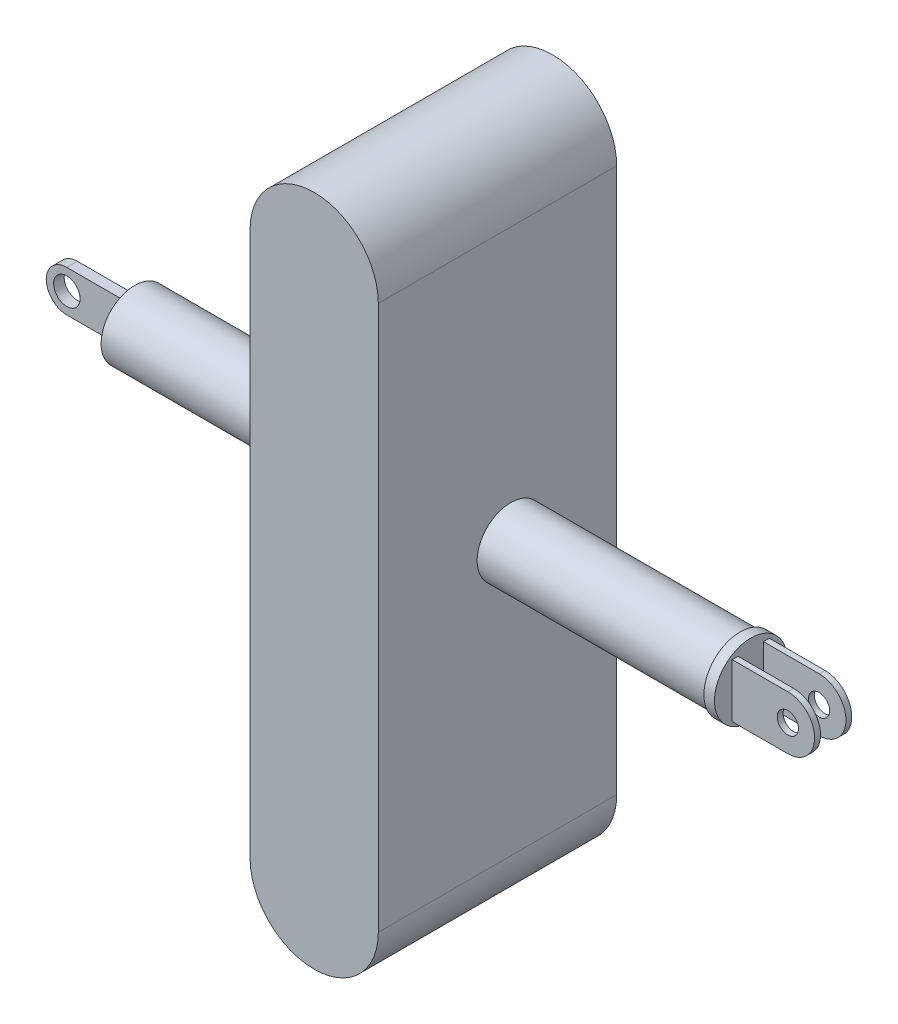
SolidWorks part; units mm, degrees
ref_plane "Front Plane" through (0, 0, 0) normal (0, 0, 1) x (1, 0, 0)
ref_plane "Top Plane" through (0, 0, 0) normal (0, 1, 0) x (1, 0, 0)
ref_plane "Right Plane" through (0, 0, 0) normal (1, 0, 0) x (0, 0, -1)
sketch "Sketch1" plane through (0, 0, 0) normal (1, 0, 0) x (0, 0, -1)
  circle A0 centre (0, 0) radius 12.7
  dimension "D1" = 25.4
extrude "Extrude1" add sketch "Sketch1" along normal blind 228.6
sketch "Sketch2" plane through (0, 0, 0) normal (0, 0, 1) x (1, 0, 0)
  line L0 (0, 0) -> (-32.8673, 0) construction
  line L1 (15.07, 0) -> (-15.07, 0) construction
  line L2 (0, 7.7781) -> (-23.6251, 7.7781)
  line L3 (0, 12.7) -> (0, -12.7) construction
  line L4 (0, -7.7781) -> (-23.6251, -7.7781)
  line L5 (0, 7.7781) -> (0, -7.7781)
  arc A0 (-23.6251, 7.7781) -> (-23.6251, -7.7781) centre (-23.6251, 0) ccw
  circle A1 centre (-23.6251, 0) radius 5
  dimension "D1" = 10
extrude "Extrude2" add sketch "Sketch2" along normal mid plane 4
sketch "Sketch3" plane through (228.6, 0, 0) normal (1, 0, 0) x (0, 0, -1)
  circle A2 centre (0, 0) radius 13.7
  circle A3 centre (0, 0) radius 13.7
  dimension "D1" = 1
extrude "Extrude3" add sketch "Sketch3" along normal blind 4
sketch "Sketch4" plane through (0, 0, 0) normal (0, 0, 1) x (1, 0, 0)
  line L0 (232.6, 10.1329) -> (253.6, 10.1329)
  line L1 (232.6, -13.7) -> (232.6, 13.7) construction
  line L2 (331.2897, 0) -> (364.956, 0) construction
  line L3 (232.6, -10.1329) -> (253.6, -10.1329)
  line L4 (232.6, 10.1329) -> (232.6, -10.1329)
  arc A0 (253.6, 10.1329) -> (253.6, -10.1329) centre (253.6, 0) cw
  circle A1 centre (253.6, 0) radius 4
  dimension "D1" = 8
  dimension "D2" = 21
extrude "Extrude4" add sketch "Sketch4" along normal mid plane 14
sketch "Sketch5" plane through (0, 0, 0) normal (0, 1, 0) x (1, 0, 0)
  line L0 (302.6802, 0) -> (363.3519, 0) construction
  line L1 (-15.07, 0) -> (15.07, 0) construction
  line L2 (232.6, -13.7) -> (232.6, 13.7) construction
  line L3 (232.6, 4.8012) -> (359.728, 4.8012)
  line L4 (232.6, 4.8012) -> (232.6, -4.8012)
  line L5 (232.6, -4.8012) -> (359.728, -4.8012)
  line L6 (359.728, 4.8012) -> (359.728, -4.8012)
  line L7 (359.728, 0) -> (232.6, 0) construction
extrude "Cut-Extrude1" cut sketch "Sketch5" against normal through all and the other way through all
sketch "Sketch6" plane through (0, 0, 0) normal (0, 0, 1) x (1, 0, 0)
  line L0 (82.3255, 0) -> (159.9018, 0) construction
  line L1 (15.07, 0) -> (-15.07, 0) construction
  line L3 (93.5607, 0) -> (141.979, 0)
  line L4 (93.5607, -102.8137) -> (93.5607, 102.8137)
  line L6 (141.979, -102.8137) -> (141.979, 102.8137)
  arc A0 (93.5607, 102.8137) -> (141.979, 102.8137) centre (117.7699, 102.8137) cw
  arc A1 (141.979, -102.8137) -> (93.5607, -102.8137) centre (117.7699, -102.8137) cw
  point P13 (93.5607, 102.8137)
extrude "Extrude5" add sketch "Sketch6" along normal blind 50 and the other way blind 40 contours A0 L4 L3 L6 | A1 L6 L3 L4
